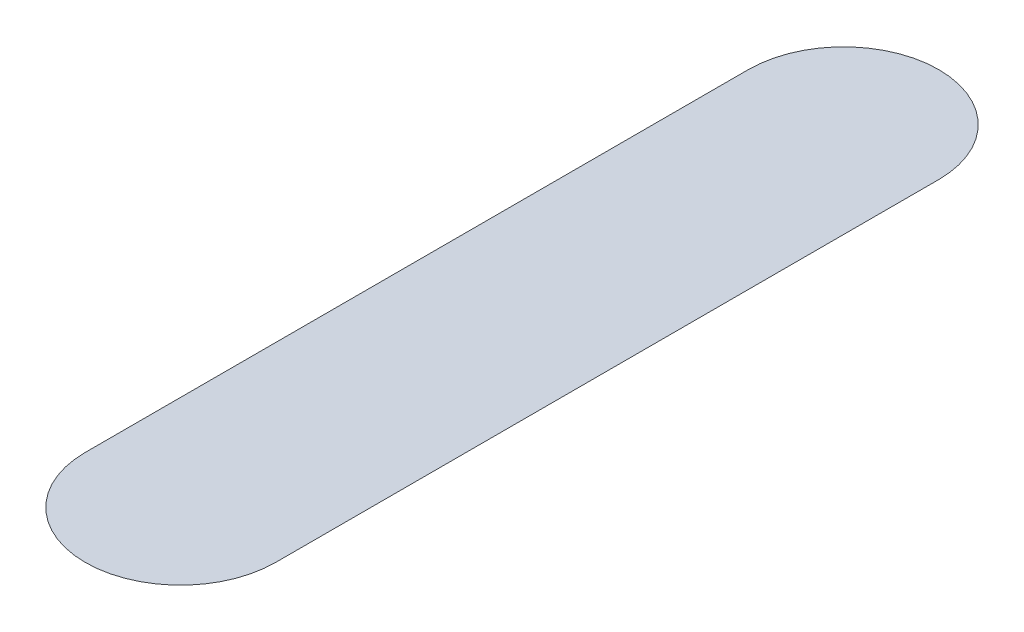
SolidWorks part; units mm, degrees
ref_plane "Plane1" through (0, 0, 0) normal (0, 0, 1) x (1, 0, 0)
ref_plane "Plane2" through (0, 0, 0) normal (0, 1, 0) x (1, 0, 0)
ref_plane "Plane3" through (0, 0, 0) normal (1, 0, 0) x (0, 0, -1)
sketch "Sketch1" plane through (0, 0, 0) normal (0, 0, 1) x (1, 0, 0)
  line L0 (-25, 5) -> (25, 5)
  line L1 (-25, 5) -> (-25, 0)
  line L2 (25, 0) -> (-25, 0)
  line L3 (25, 0) -> (25, 5)
  line L4 (0, 5) -> (0, 0) construction
  line L5 (50, 0) -> (-50, 0) construction
  dimension "D1" = 50
  dimension "D2" = 5
extrude "Base-Extrude" add sketch "Sketch1" along normal mid plane 140
sketch "Sketch10" plane through (0, 0, 0) normal (0, 1, 0) x (-1, 0, 0)
  line L4 (10, 40) -> (10, -40) construction
  line L5 (0, 50) -> (0, -50) construction
  line L6 (-10, 40) -> (-10, -40) construction
  line L8 (-10, 0) -> (10, 0) construction
  arc A0 (10, -40) -> (-10, -40) centre (0, -40) cw construction
  arc A1 (-10, 40) -> (10, 40) centre (0, 40) cw construction
  dimension "Rib Length" = 100
  dimension "Rib Width" = 20
ref_plane "Plane4" through (0, 0, -40) normal (0, 0, 1) x (1, 0, 0)
ref_plane "Plane5" through (0, 0, 40) normal (0, 0, 1) x (1, 0, 0)
sketch "Sketch2" plane through (0, 0, -40) normal (0, 0, 1) x (1, 0, 0)
  line L0 (25, 0) -> (-25, 0) construction
  line L1 (0, -50) -> (0, 50) construction
  line L2 (10, 0) -> (-10, 0)
  arc A0 (-10, 0) -> (10, 0) centre (0, 10.5) ccw
  dimension "Height" = 4
extrude "Boss-Extrude1" add sketch "Sketch2" along normal up to surface (80 mm away)
sketch "Sketch7" plane through (0, 0, 40) normal (0, 0, 1) x (1, 0, 0)
  line L0 (0, 0.9975) -> (0, -6.5364) construction
  line L1 (0, 0) -> (0, -4)
  line L2 (10, 0) -> (-10, 0)
  line L3 (0, 0) -> (-10, 0)
  arc A1 (-10, 0) -> (10, 0) centre (0, 10.5) ccw
  arc A2 (-10, 0) -> (0, -4) centre (0, 10.5) ccw
  dimension "D1" = 0
revolve "Boss-Revolve3" add sketch "Sketch7" angle 180 about L0
sketch "Sketch9" plane through (0, 0, -40) normal (0, 0, 1) x (1, 0, 0)
  line L0 (0, 0.9975) -> (0, -6.5364) construction
  line L1 (0, 0) -> (0, -4)
  line L2 (10, 0) -> (-10, 0) construction
  line L3 (0, 0) -> (-10, 0)
  arc A2 (-10, 0) -> (0, -4) centre (0, 10.5) ccw
revolve "Boss-Revolve4" add sketch "Sketch9" angle 180 about L0
fillet "Fillet3" radius 4 4 edges at (-10, 0, 0) (10, 0, 0) (0, 0, 50) (0, 0, -50)
sketch "Sketch3" plane through (-25, 0, 0) normal (-1, 0, 0) x (0, 0, 1)
  line L4 (-70, 0) -> (70, 0)
  line L5 (70, 0) -> (70, 5)
  line L6 (70, 5) -> (-70, 5)
  line L7 (-70, 5) -> (-70, 0)
  line L8 (-70, 0) -> (70, 0)
  line L9 (70, 0) -> (70, 5)
  line L10 (70, 5) -> (-70, 5)
  line L11 (-70, 5) -> (-70, 0)
  dimension "D1" = 0
extrude "Cut-Extrude1" cut sketch "Sketch3" against normal through all
sketch "Orientation Sketch" plane through (0, 0, 0) normal (0, 1, 0) x (-1, 0, 0)
  line L2 (11.4891, -40) -> (11.4891, 40)
  line L3 (-11.4891, 40) -> (-11.4891, -40)
  line L4 (11.4891, -40) -> (11.4891, 40)
  line L5 (-11.4891, 40) -> (-11.4891, -40)
  arc A2 (11.4891, 40) -> (-11.4891, 40) centre (0, 40) ccw
  arc A3 (-11.4891, -40) -> (11.4891, -40) centre (0, -40) ccw
  arc A4 (11.4891, 40) -> (-11.4891, 40) centre (0, 40) ccw
  arc A5 (-11.4891, -40) -> (11.4891, -40) centre (0, -40) ccw
  dimension "D1" = 0
